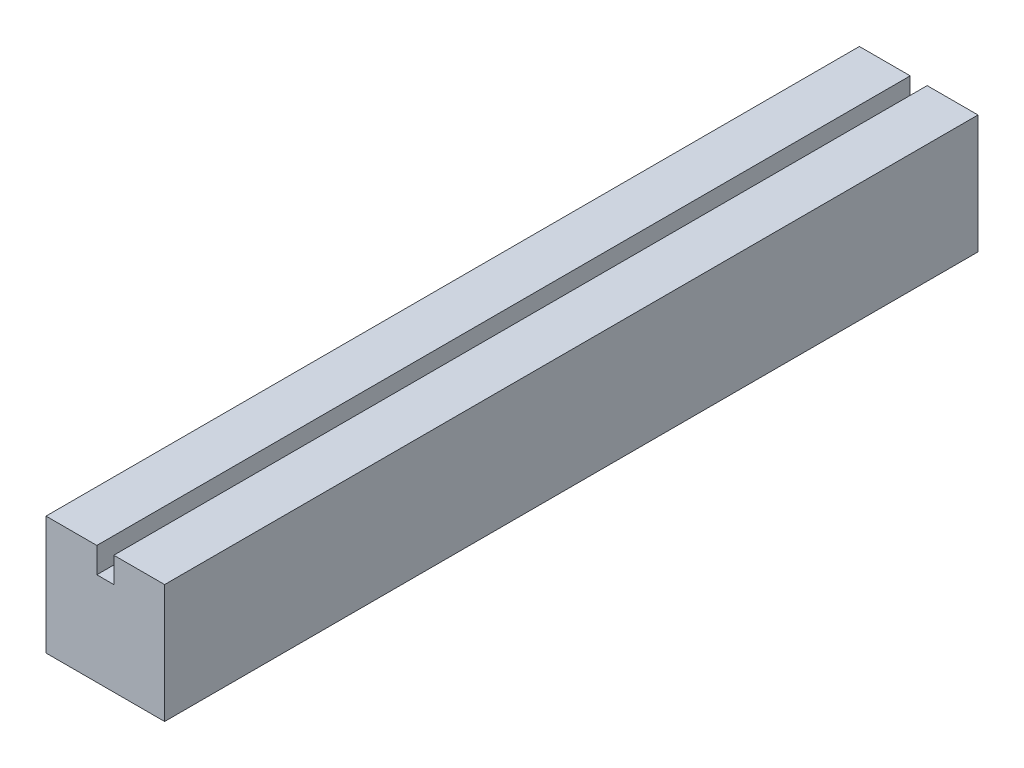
SolidWorks part; units mm, degrees
ref_plane "Front Plane" through (0, 0, 0) normal (0, 0, 1) x (1, 0, 0)
ref_plane "Top Plane" through (0, 0, 0) normal (0, 1, 0) x (1, 0, 0)
ref_plane "Right Plane" through (0, 0, 0) normal (1, 0, 0) x (0, 0, -1)
sketch "Sketch1" plane through (0, 0, 0) normal (0, 0, 1) x (1, 0, 0)
  line L1 (-44.45, 44.45) -> (44.45, 44.45)
  line L2 (-44.45, 44.45) -> (-44.45, -44.45)
  line L3 (-44.45, -44.45) -> (44.45, -44.45)
  line L4 (44.45, 44.45) -> (44.45, -44.45)
  line L5 (-44.45, 44.45) -> (44.45, -44.45) construction
  line L6 (-44.45, -44.45) -> (44.45, 44.45) construction
  line L7 (-6.35, 44.45) -> (6.35, 44.45)
  line L8 (-6.35, 44.45) -> (-6.35, 25.4)
  line L9 (-6.35, 25.4) -> (6.35, 25.4)
  line L10 (6.35, 44.45) -> (6.35, 25.4)
  point P0 (0, 0)
  dimension "D1" = 88.9
  dimension "D2" = 88.9
  dimension "D3" = 38.1
  dimension "D4" = 12.7
  dimension "D5" = 19.05
extrude "Boss-Extrude1" add sketch "Sketch1" along normal blind 609.6 contours L1 L10 L9 L8 L2 L3 L4
